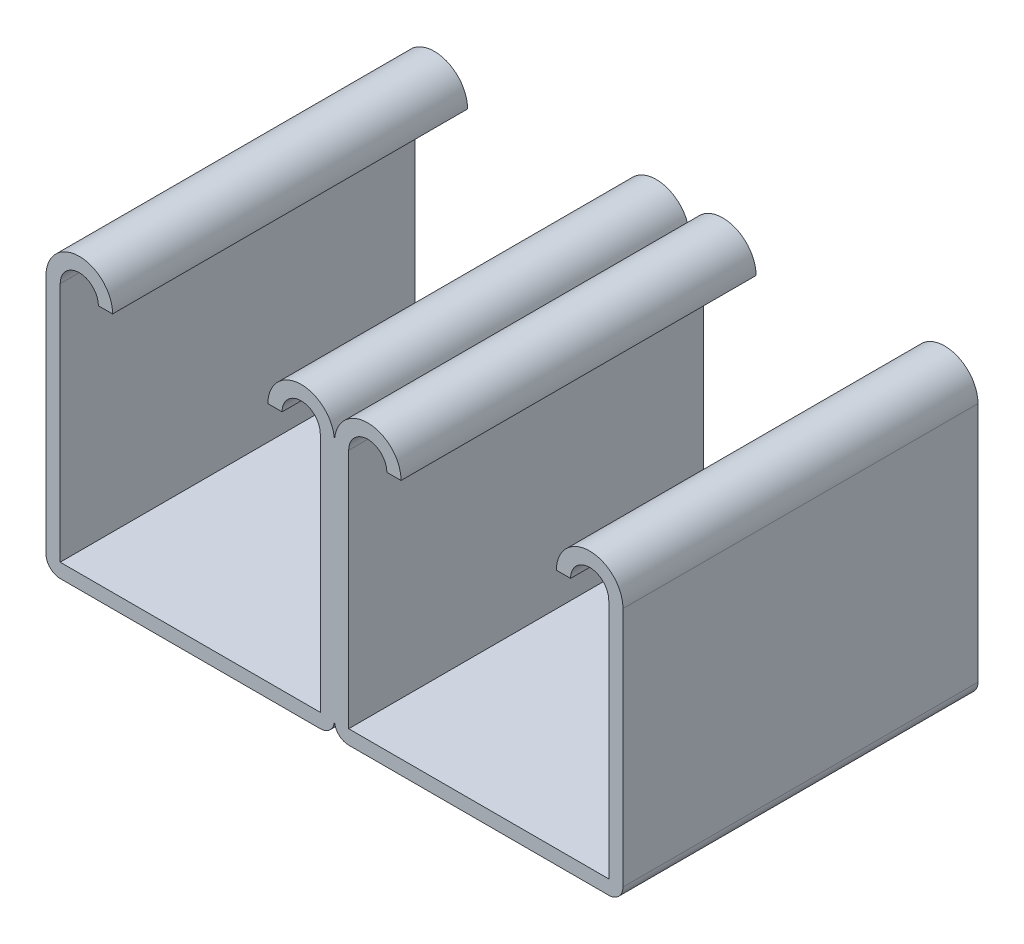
SolidWorks part; units mm, degrees
ref_plane "Plane1" through (0, 0, 0) normal (0, 0, 1) x (1, 0, 0)
ref_plane "Plane2" through (0, 0, 0) normal (0, 1, 0) x (1, 0, 0)
ref_plane "Plane3" through (0, 0, 0) normal (1, 0, 0) x (0, 0, -1)
sketch "Sketch1" plane through (0, 0, 0) normal (0, 0, 1) x (1, 0, 0)
  line L0 (-20.6375, 9.3789) -> (-20.6375, -7.874)
  line L1 (-19.6215, -8.89) -> (-1.016, -8.89)
  line L2 (0, -7.874) -> (0, 9.3789)
  line L6 (-19.6215, 9.3789) -> (-19.6215, -7.874)
  line L7 (-19.6215, -7.874) -> (-1.016, -7.874)
  line L8 (-1.016, -7.874) -> (-1.016, 9.3789)
  line L10 (-44.483, 11.7602) -> (25.4, 11.7602) construction
  line L12 (-16.891, 9.3789) -> (-15.875, 9.3789)
  line L13 (-4.7625, 9.3789) -> (-3.7465, 9.3789)
  arc A0 (0, 9.3789) -> (-4.7625, 9.3789) centre (-2.3813, 9.3789) ccw
  arc A1 (-20.6375, 9.3789) -> (-15.875, 9.3789) centre (-18.2563, 9.3789) cw
  arc A2 (-19.6215, -8.89) -> (-20.6375, -7.874) centre (-19.6215, -7.874) cw
  arc A3 (-1.016, -8.89) -> (0, -7.874) centre (-1.016, -7.874) ccw
  arc A4 (-19.6215, 9.3789) -> (-16.891, 9.3789) centre (-18.2563, 9.3789) cw
  arc A5 (-1.016, 9.3789) -> (-3.7465, 9.3789) centre (-2.3813, 9.3789) ccw
  dimension "D1" = 1.016
  dimension "D3" = 11.1125
  dimension "D4" = 4.7625
  dimension "Width" = 20.6375
  dimension "D5" = 8.89
  dimension "D6" = 1.016
  dimension "D8" = 11.7602
  dimension "D2" = 4.7625
  dimension "gauge" = 1.016
extrude "Base-Extrude" add sketch "Sketch1" along normal mid plane 25.4
pattern_linear "LPattern1" count 2 spacing 20.6375 along (1, 0, 0) of "Base-Extrude"
equation "\"D1@Sketch1\" = \"gauge@Sketch1\""
